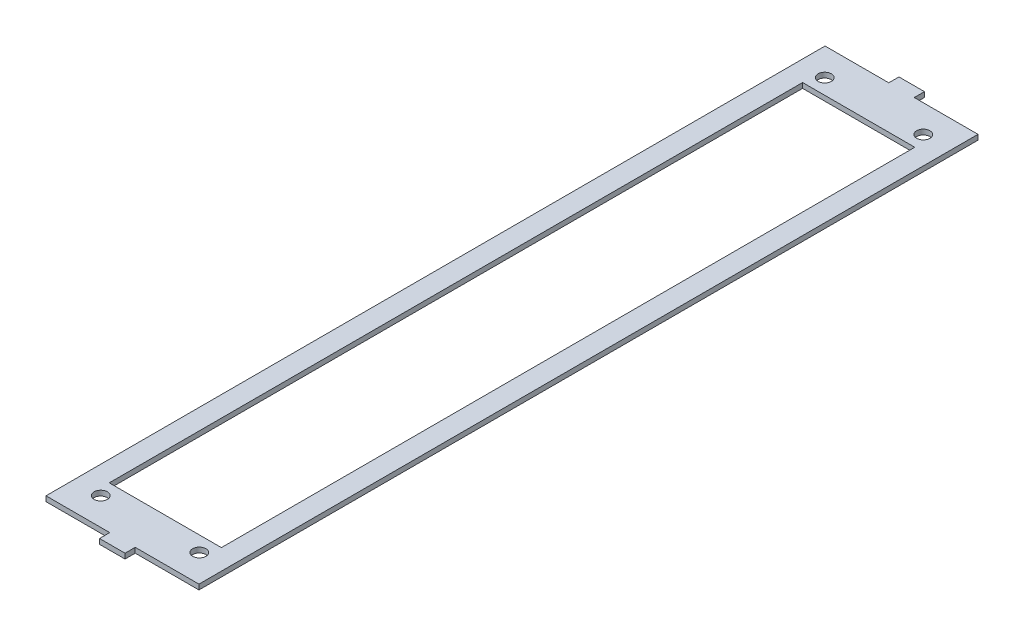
SolidWorks part; units mm, degrees
ref_plane "Alzado" through (0, 0, 0) normal (0, 0, 1) x (1, 0, 0)
ref_plane "Planta" through (0, 0, 0) normal (0, 1, 0) x (1, 0, 0)
ref_plane "Vista lateral" through (0, 0, 0) normal (1, 0, 0) x (0, 0, -1)
sketch "Croquis1" plane through (0, 0, 0) normal (0, 1, 0) x (1, 0, 0)
  line L0 (0, -408) -> (-12, -408) construction
  line L1 (0, 0) -> (66, 0)
  line L2 (0, 0) -> (0, -408)
  line L3 (0, -408) -> (66, -408)
  line L4 (66, 0) -> (66, -408)
  line L5 (-12, -408) -> (-12, -433.2) construction
  line L6 (-12, 25.2) -> (-12, 9) construction
  line L7 (-12, -433.2) -> (25.5, -433.2)
  line L8 (-12, -433.2) -> (-12, 25.2)
  line L9 (-12, 25.2) -> (25.5, 25.2)
  line L10 (78, -433.2) -> (78, 25.2)
  line L11 (-12, 9) -> (4, 9) construction
  line L12 (33, 25.2) -> (33, -433.2) construction
  line L13 (-12, -204) -> (78, -204) construction
  line L14 (40.5, -433.2) -> (78, -433.2)
  line L15 (25.5, -439.2) -> (40.5, -439.2)
  line L16 (25.5, -439.2) -> (25.5, -433.2)
  line L17 (25.5, 31.2) -> (40.5, 31.2)
  line L18 (40.5, -439.2) -> (40.5, -433.2)
  line L19 (25.5, -439.2) -> (40.5, -433.2) construction
  line L20 (25.5, -433.2) -> (40.5, -439.2) construction
  line L21 (25.5, 31.2) -> (25.5, 25.2)
  line L22 (40.5, 31.2) -> (40.5, 25.2)
  line L23 (40.5, 25.2) -> (78, 25.2)
  circle A0 centre (4, 9) radius 3.9
  circle A1 centre (62, 9) radius 3.9
  circle A2 centre (62, -417) radius 3.9
  circle A3 centre (4, -417) radius 3.9
  point P23 (33, -436.2)
  point P28 (0, 0)
  point P33 (0, 0)
  dimension "D9" = 7.8
  dimension "D1" = 408
  dimension "D2" = 66
  dimension "D3" = 12
  dimension "D4" = 25.2
  dimension "D5" = 458.4
  dimension "D6" = 90
  dimension "D7" = 16.2
  dimension "D8" = 16
  dimension "D10" = 15
  dimension "D11" = 6
  dimension "D12" = 45
extrude "Saliente-Extruir1" add sketch "Croquis1" along normal blind 3
